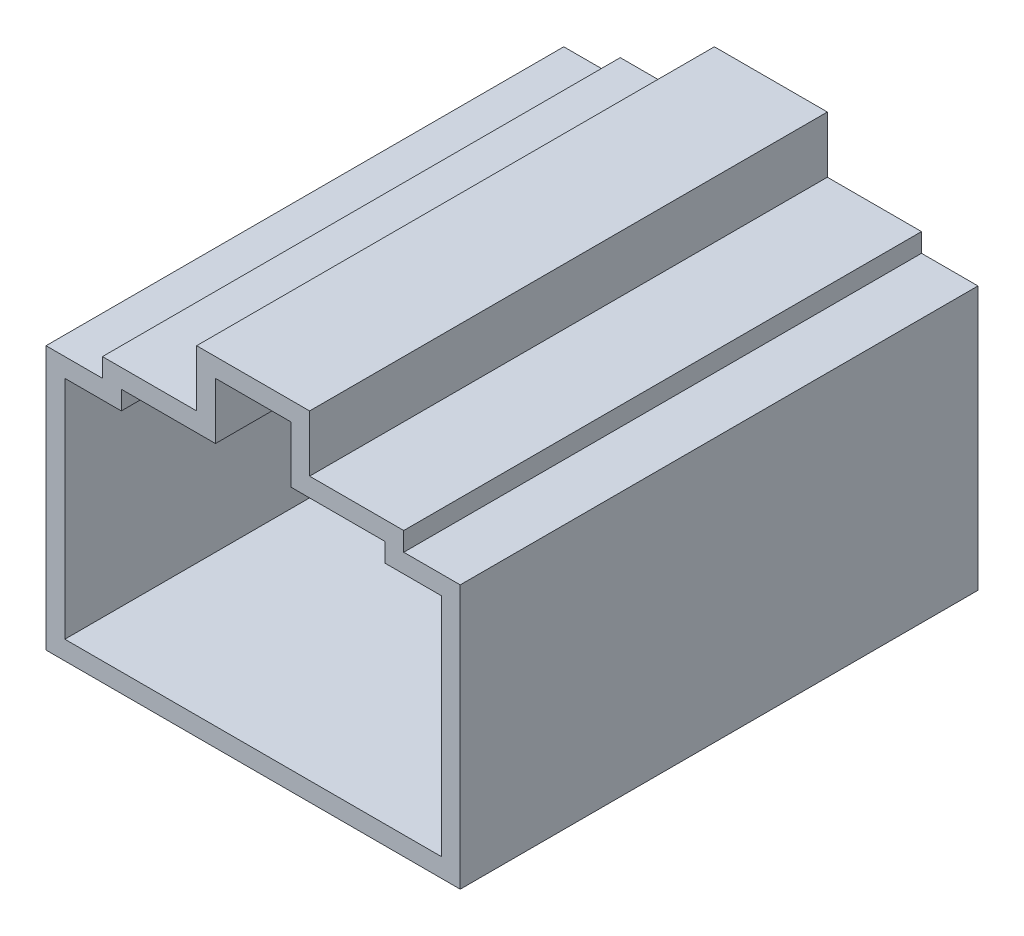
SolidWorks part; units mm, degrees
ref_plane "Front Plane" through (0, 0, 0) normal (0, 0, 1) x (1, 0, 0)
ref_plane "Top Plane" through (0, 0, 0) normal (0, 1, 0) x (1, 0, 0)
ref_plane "Right Plane" through (0, 0, 0) normal (1, 0, 0) x (0, 0, -1)
sketch "Sketch1" plane through (0, 0, 0) normal (0, 0, 1) x (1, 0, 0)
  line L0 (9.75, -11.1213) -> (-12.25, -11.1213)
  line L1 (-12.25, -11.1213) -> (-12.25, 2.8787)
  line L2 (-12.25, 2.8787) -> (-9.25, 2.8787)
  line L3 (-9.25, 2.8787) -> (-9.25, 3.8787)
  line L4 (-9.25, 3.8787) -> (-4.25, 3.8787)
  line L5 (-4.25, 3.8787) -> (-4.25, 6.8787)
  line L6 (-4.25, 6.8787) -> (1.75, 6.8787)
  line L7 (8.75, -10.1213) -> (-11.25, -10.1213)
  line L8 (1.75, 3.8787) -> (1.75, 6.8787)
  line L9 (6.75, 3.8787) -> (1.75, 3.8787)
  line L10 (6.75, 2.8787) -> (6.75, 3.8787)
  line L11 (9.75, 2.8787) -> (6.75, 2.8787)
  line L12 (9.75, -11.1213) -> (9.75, 2.8787)
  line L13 (-11.25, -10.1213) -> (-11.25, 1.8787)
  line L14 (-11.25, 1.8787) -> (-8.25, 1.8787)
  line L15 (-8.25, 1.8787) -> (-8.25, 2.8787)
  line L16 (-8.25, 2.8787) -> (-3.25, 2.8787)
  line L17 (-3.25, 2.8787) -> (-3.25, 5.8787)
  line L18 (-3.25, 5.8787) -> (0.75, 5.8787)
  line L19 (0.75, 2.8787) -> (0.75, 5.8787)
  line L20 (5.75, 2.8787) -> (0.75, 2.8787)
  line L21 (5.75, 1.8787) -> (5.75, 2.8787)
  line L22 (8.75, 1.8787) -> (5.75, 1.8787)
  line L23 (8.75, -10.1213) -> (8.75, 1.8787)
  point P17 (-1.25, -11.1213)
  dimension "D1" = 11
  dimension "D2" = 14
  dimension "D3" = 3
  dimension "D4" = 6
  dimension "D5" = 1
  dimension "D6" = 3
  dimension "D7" = 1
extrude "Boss-Extrude1" add sketch "Sketch1" along normal blind 27.5
